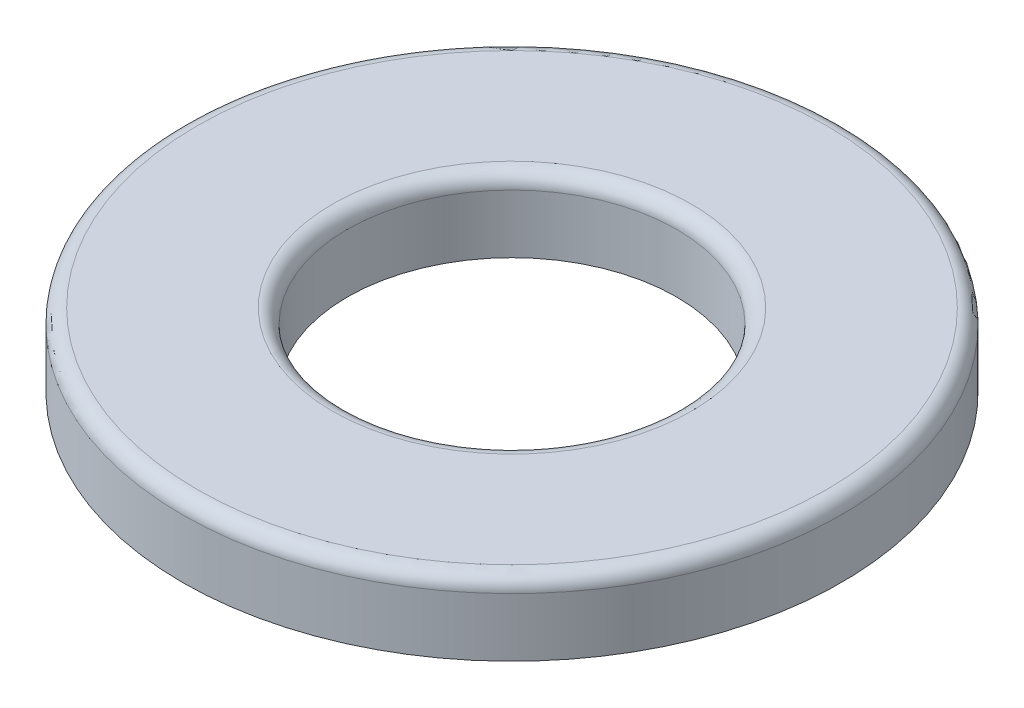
SolidWorks part; units mm, degrees
ref_plane "前视基准面" through (0, 0, 0) normal (0, 0, 1) x (1, 0, 0)
ref_plane "上视基准面" through (0, 0, 0) normal (0, 1, 0) x (1, 0, 0)
ref_plane "右视基准面" through (0, 0, 0) normal (1, 0, 0) x (0, 0, -1)
sketch "草图1" plane through (0, 0, 0) normal (0, 1, 0) x (1, 0, 0)
  circle A0 centre (0, 0) radius 4.5
  circle A1 centre (0, 0) radius 2.25
  dimension "D1" = 4.5
  dimension "D2" = 9
extrude "凸台-拉伸1" add sketch "草图1" along normal mid plane 1
fillet "圆角1" radius 0.2 2 edges at (0, 0.5, 4.5) (0, 0.5, 2.25)
